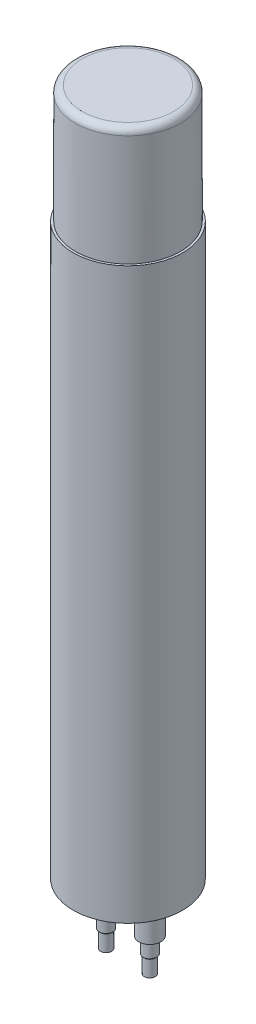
SolidWorks part; units mm, degrees
ref_plane "Front Plane" through (0, 0, 0) normal (0, 0, 1) x (1, 0, 0)
ref_plane "Top Plane" through (0, 0, 0) normal (0, 1, 0) x (1, 0, 0)
ref_plane "Right Plane" through (0, 0, 0) normal (1, 0, 0) x (0, 0, -1)
sketch "Sketch1" plane through (0, 0, 0) normal (0, 0, 1) x (1, 0, 0)
  line L0 (0, 0) -> (0, -104.1172) construction
  line L1 (0, 0) -> (60.96, 0)
  line L2 (60.96, 0) -> (60.96, -136.652)
  line L3 (60.96, -136.652) -> (63.5, -136.652)
  line L4 (63.5, -136.652) -> (63.5, -797.052)
  line L5 (63.5, -797.052) -> (0, -797.052)
  line L6 (0, 0) -> (0, -797.052)
  dimension "D1" = 63.5
  dimension "D2" = 60.96
  dimension "D3" = 660.4
  dimension "D4" = 136.652
revolve "Revolve1" add sketch "Sketch1" angle 360 about L6
fillet "Fillet1" radius 7.9248 1 edges at (-60.96, 0, 0)
sketch "Sketch2" plane through (0, -797.052, 0) normal (0, -1, 0) x (1, 0, 0)
  circle A1 centre (25.4, 0) radius 12.7
  dimension "D1" = 25.4
  dimension "D2" = 25.4
extrude "Extrude1" add sketch "Sketch2" along normal blind 44.45
sketch "Sketch4" plane through (0, 0, 0) normal (0, 0, 1) x (1, 0, 0)
  line L0 (25.4, -841.502) -> (25.4, -879.602)
  line L1 (12.7, -841.502) -> (38.1, -841.502) construction
  line L2 (25.4, -841.502) -> (25.4, -797.052) construction
  line L3 (25.4, -879.602) -> (31.75, -879.602)
  line L4 (33.2798, -859.282) -> (31.75, -860.8118)
  line L5 (31.75, -860.8118) -> (31.75, -879.602)
  line L6 (33.2798, -859.282) -> (33.2798, -841.502)
  line L7 (25.4, -841.502) -> (33.2798, -841.502)
  dimension "D1" = 7.8798
  dimension "D2" = 6.35
  dimension "D3" = 17.78
  dimension "D4" = 38.1
  dimension "D5" = 135
revolve "Revolve2" add sketch "Sketch4" angle 360 about axis through (25.4, -841.502, 0) along (0, 1, 0)
mirror "Mirror1" about plane through (0, 0, 0) normal (1, 0, 0) of "Revolve2", "Extrude1"
